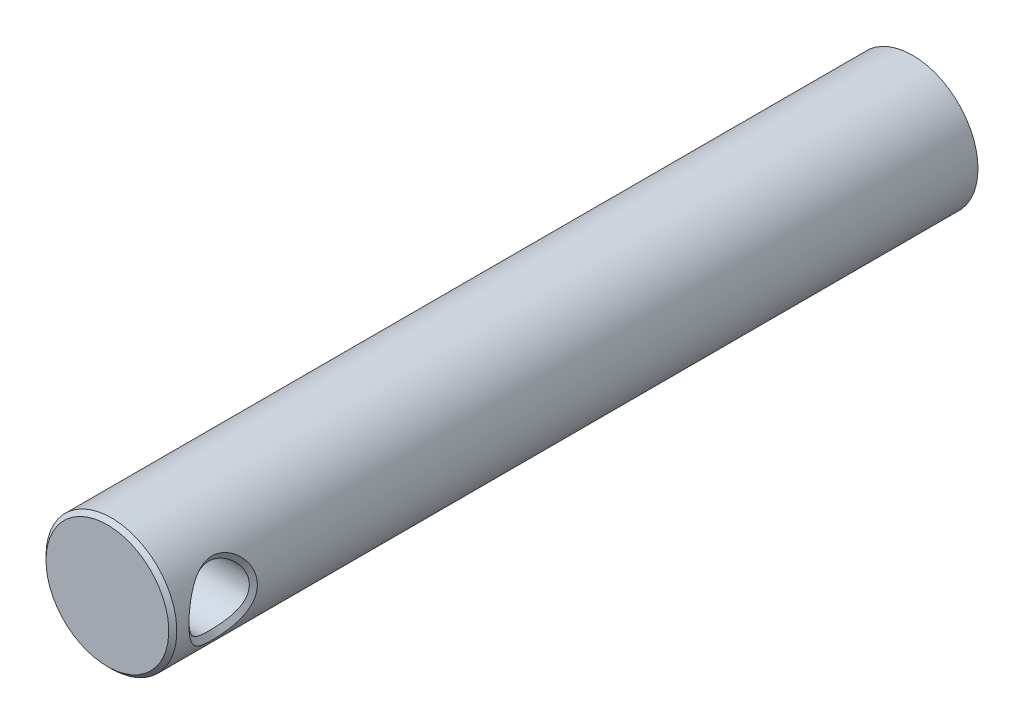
SolidWorks part; units mm, degrees
ref_plane "Plan de face" through (0, 0, 0) normal (0, 0, 1) x (1, 0, 0)
ref_plane "Plan de dessus" through (0, 0, 0) normal (0, 1, 0) x (1, 0, 0)
ref_plane "Plan de droite" through (0, 0, 0) normal (1, 0, 0) x (0, 0, -1)
sketch "Esquisse1" plane through (0, 0, 0) normal (0, 0, 1) x (1, 0, 0)
  circle A0 centre (0, 0) radius 32.5
  dimension "D1" = 65
extrude "Extrusion1" add sketch "Esquisse1" along normal blind 400
chamfer "Chanfrein1" distance 2 angle 45 1 edges at (32.5, 0, 400)
sketch "Esquisse2" plane through (0, 0, 0) normal (1, 0, 0) x (0, 0, -1)
  line L0 (-400, 30.5) -> (-400, -30.5) construction
  circle A0 centre (-375, 0) radius 15
  dimension "D1" = 30
  dimension "D2" = 25
extrude "Enlèv. mat.-Extru.1" cut sketch "Esquisse2" against normal mid plane 400
chamfer "Chanfrein2" distance 2 angle 45 2 edges at (-32.4511, 1.7815, 360.1062) (32.4511, 1.7815, 389.8938)
